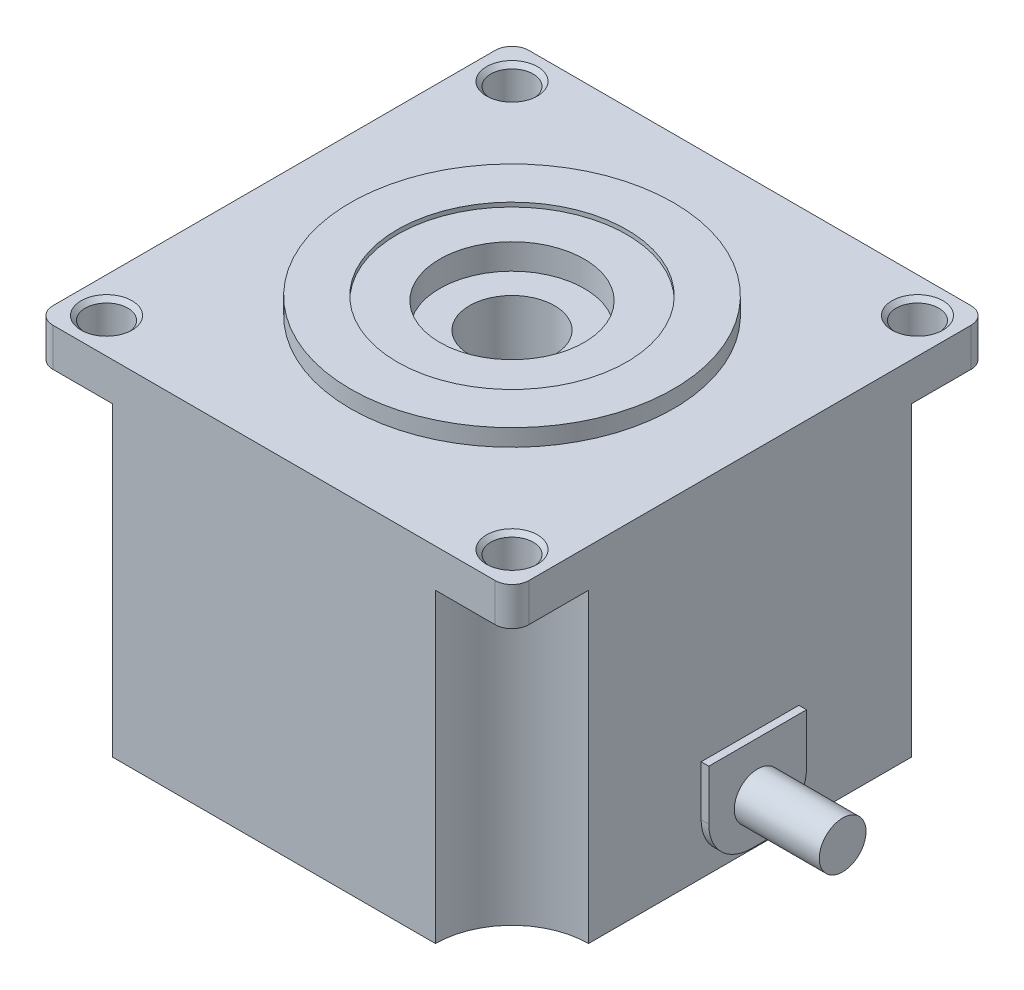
SolidWorks part; units mm, degrees
ref_plane "Front Plane" through (0, 0, 0) normal (0, 0, 1) x (1, 0, 0)
ref_plane "Top Plane" through (0, 0, 0) normal (0, 1, 0) x (1, 0, 0)
ref_plane "Right Plane" through (0, 0, 0) normal (1, 0, 0) x (0, 0, -1)
sketch "Sketch1" plane through (0, 0, 0) normal (0, 1, 0) x (1, 0, 0)
  line L1 (-28, 28) -> (28, 28)
  line L2 (-28, 28) -> (-28, -28)
  line L3 (-28, -28) -> (28, -28)
  line L4 (28, 28) -> (28, -28)
  line L5 (-28, 28) -> (28, -28) construction
  line L6 (-28, -28) -> (28, 28) construction
  point P0 (0, 0)
  dimension "D2" = 56
extrude "Boss-Extrude1" add sketch "Sketch1" along normal blind 40.5
fillet "Fillet1" radius 2 4 edges at (-28, 20.25, -28) (28, 20.25, -28) (28, 20.25, 28) (-28, 20.25, 28)
sketch "Sketch3" plane through (0, 40.5, 0) normal (0, 1, 0) x (1, 0, 0)
  circle A0 centre (0, 0) radius 19
  dimension "D1" = 38
extrude "Boss-Extrude2" add sketch "Sketch3" along normal blind 2
sketch "Sketch4" plane through (0, 42.5, 0) normal (0, 1, 0) x (1, 0, 0)
  circle A0 centre (0, 0) radius 13.5
  dimension "D1" = 27
extrude "Cut-Extrude1" cut sketch "Sketch4" against normal blind 0.5
sketch "Sketch5" plane through (0, 42, 0) normal (0, 1, 0) x (1, 0, 0)
  circle A0 centre (0, 0) radius 8.5
  dimension "D1" = 17
extrude "Cut-Extrude2" cut sketch "Sketch5" against normal blind 3
sketch "Sketch6" plane through (0, 39, 0) normal (0, 1, 0) x (1, 0, 0)
  circle A0 centre (0, 0) radius 5
extrude "Cut-Extrude3" cut sketch "Sketch6" against normal through all
sketch "Sketch7" plane through (0, 0, 0) normal (0, -1, 0) x (1, 0, 0)
  line L4 (-28, 26) -> (-28, -26)
  line L5 (-26, -28) -> (26, -28)
  line L6 (28, -26) -> (28, 26)
  line L7 (26, 28) -> (-26, 28)
  line L8 (-28, 26) -> (-28, -26)
  line L9 (-26, -28) -> (26, -28)
  line L10 (28, -26) -> (28, 26)
  line L11 (26, 28) -> (-26, 28)
  circle A0 centre (-28, 28) radius 9
  circle A1 centre (28, 28) radius 9
  circle A2 centre (28, -28) radius 9
  circle A3 centre (-28, -28) radius 9
  arc A4 (-28, -26) -> (-26, -28) centre (-26, -26) ccw
  arc A5 (26, -28) -> (28, -26) centre (26, -26) ccw
  arc A6 (28, 26) -> (26, 28) centre (26, 26) ccw
  arc A7 (-26, 28) -> (-28, 26) centre (-26, 26) ccw
  arc A8 (-28, -26) -> (-26, -28) centre (-26, -26) ccw
  arc A9 (26, -28) -> (28, -26) centre (26, -26) ccw
  arc A10 (28, 26) -> (26, 28) centre (26, 26) ccw
  arc A11 (-26, 28) -> (-28, 26) centre (-26, 26) ccw
  dimension "D2" = 18
  dimension "D1" = 0
extrude "Cut-Extrude4" cut sketch "Sketch7" against normal offset from surface (36 mm away) 4.5 contours A3 M12 M10 M11 | A0 L11 M10 M17 | A1 L10 M16 M15 | A2 L9 M14 M13
sketch "Sketch8" plane through (0, 40.5, 0) normal (0, 1, 0) x (1, 0, 0)
  line L0 (23.85, 26.35) -> (23.85, 28) construction
  line L2 (26, 28) -> (-26, 28) construction
  line L4 (23.85, 28) -> (28, 23.85) construction
  line L5 (28, -26) -> (28, 26) construction
  line L6 (28, 23.85) -> (26.35, 23.85) construction
  circle A2 centre (23.85, 23.85) radius 2.5
  dimension "D1" = 1.65
  dimension "D2" = 5
extrude "Cut-Extrude5" cut sketch "Sketch8" against normal through all
chamfer "Chamfer1" distance 0.5 angle 45 1 edges at (23.85, 40.5, -26.35)
mirror "Mirror1" about plane through (0, 0, 0) normal (0, 0, 1) of "Chamfer1", "Cut-Extrude5"
mirror "Mirror2" about plane through (0, 0, 0) normal (1, 0, 0) of "Chamfer1", "Cut-Extrude5", "Mirror1"
sketch "Sketch9" plane through (28, 0, 0) normal (1, 0, 0) x (0, 0, -1)
  line L0 (0, 40.5) -> (0, 0) construction
  line L1 (-26, 40.5) -> (26, 40.5) construction
  line L2 (-19, 0) -> (19, 0) construction
  line L3 (-0.75, 1) -> (0.75, 1)
  line L4 (-5.75, 6) -> (-5.75, 11.9)
  line L5 (-5.75, 11.9) -> (5.75, 11.9)
  line L6 (5.75, 6) -> (5.75, 11.9)
  line L7 (-5.75, 1) -> (5.75, 11.9) construction
  line L8 (-5.75, 11.9) -> (5.75, 1) construction
  arc A0 (0.75, 1) -> (5.75, 6) centre (0.75, 6) ccw
  arc A1 (-0.75, 1) -> (-5.75, 6) centre (-0.75, 6) cw
  point P5 (0, 6.45)
  dimension "D4" = 5
  dimension "D1" = 11.5
  dimension "D2" = 1
  dimension "D3" = 10.9
extrude "Boss-Extrude3" add sketch "Sketch9" along normal blind 0.9 separate body
sketch "Sketch10" plane through (28.9, 0, 0) normal (1, 0, 0) x (0, 0, -1)
  line L0 (0, 11.9) -> (0, 6) construction
  line L1 (5.75, 11.9) -> (-5.75, 11.9) construction
  line L2 (0, 6) -> (5.75, 6) construction
  line L3 (5.75, 6) -> (5.75, 11.9) construction
  line L4 (-0.75, 1) -> (0.75, 1) construction
  line L5 (0, 6) -> (-5.75, 6) construction
  circle A0 centre (0, 6) radius 2.75
  dimension "D1" = 5.5
  dimension "D2" = 5
extrude "Boss-Extrude4" add sketch "Sketch10" along normal blind 10
